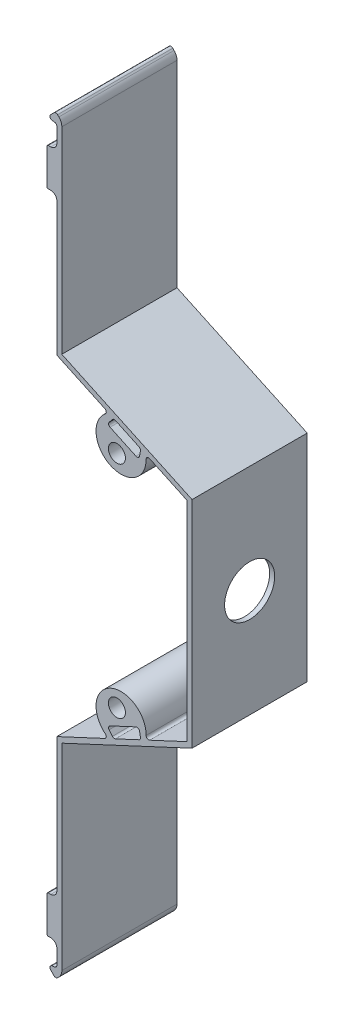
SolidWorks part; units mm, degrees
ref_plane "前视基准面" through (0, 0, 0) normal (0, 0, 1) x (1, 0, 0)
ref_plane "上视基准面" through (0, 0, 0) normal (0, 1, 0) x (1, 0, 0)
ref_plane "右视基准面" through (0, 0, 0) normal (1, 0, 0) x (0, 0, -1)
other "Configuration Table"
sketch "草图1" plane through (0, 0, 0) normal (0, 0, 1) x (1, 0, 0)
  line L2 (95, -72.9584) -> (95, -33.624) construction
  line L3 (95, -33.624) -> (121, -21.5) construction
  line L4 (95, -72.9584) -> (95, -33.624)
  line L5 (95, -33.624) -> (121, -21.5)
  line L7 (121, -21.5) -> (121, 21.5)
  line L8 (95, 33.624) -> (95, 72.9584) construction
  line L9 (95, 33.624) -> (95, 72.9584)
  line L10 (121, -21.5) -> (121, 21.5) construction
  line L11 (120, -20.8629) -> (120, 20.8629)
  line L12 (120, -20.8629) -> (112.5426, -24.3404)
  line L13 (121, 0) -> (102.4527, 0) construction
  line L14 (103.5873, -28.5163) -> (94, -32.9869)
  line L15 (94, -32.9869) -> (94, -72.5446)
  line L16 (93.5609, -73.0408) -> (93.0647, -73.1018)
  line L17 (74.3726, -94.4142) -> (94.4142, -74.3726) construction
  line L18 (94.4142, -74.3726) -> (94.1572, -74.6296)
  line L19 (93.4501, -74.6296) -> (92.772, -73.9516)
  line L20 (93.4501, 74.6296) -> (92.772, 73.9516)
  line L21 (94.4142, 74.3726) -> (94.1572, 74.6296)
  line L22 (93.5609, 73.0408) -> (93.0647, 73.1018)
  line L23 (94, 32.9869) -> (94, 72.5446)
  line L24 (103.5873, 28.5163) -> (94, 32.9869)
  line L25 (120, 20.8629) -> (112.5426, 24.3404)
  line L26 (95, 33.624) -> (121, 21.5)
  line L27 (95, 72.9584) -> (95, 33.624)
  arc A0 (111.8314, -23.8779) -> (103.6902, -27.6742) centre (106.8323, -23.7848) ccw
  arc A1 (94.4142, -74.3726) -> (95, -72.9584) centre (93, -72.9584) ccw construction
  arc A2 (94.4142, -74.3726) -> (95, -72.9584) centre (93, -72.9584) ccw
  arc A3 (94, -72.5446) -> (93.5609, -73.0408) centre (93.5, -72.5446) cw
  arc A4 (94.1572, -74.6296) -> (93.4501, -74.6296) centre (93.8036, -74.2761) cw
  arc A5 (93.0647, -73.1018) -> (92.772, -73.9516) centre (93.1256, -73.598) ccw
  arc A6 (93.0647, 73.1018) -> (92.772, 73.9516) centre (93.1256, 73.598) cw
  arc A7 (94.1572, 74.6296) -> (93.4501, 74.6296) centre (93.8036, 74.2761) ccw
  arc A8 (94, 72.5446) -> (93.5609, 73.0408) centre (93.5, 72.5446) ccw
  arc A9 (94.4142, 74.3726) -> (95, 72.9584) centre (93, 72.9584) cw
  arc A10 (111.8314, 23.8779) -> (103.6902, 27.6742) centre (106.8323, 23.7848) cw
  circle A15 centre (106, 22) radius 1.7
  circle A16 centre (106, -22) radius 1.7
  arc A17 (103.6902, -27.6742) -> (103.5873, -28.5163) centre (103.376, -28.0631) cw
  arc A18 (112.5426, -24.3404) -> (111.8314, -23.8779) centre (112.3313, -23.8872) cw
  arc A19 (111.8314, 23.8779) -> (112.5426, 24.3404) centre (112.3313, 23.8872) cw
  arc A20 (103.6902, 27.6742) -> (103.5873, 28.5163) centre (103.376, 28.0631) ccw
  point P27 (94, -72.9869)
  point P30 (93.8036, -74.9832)
  point P50 (120, 0)
  point P51 (121, 0)
  point P53 (93.8036, 74.9832)
  point P54 (94, 72.9869)
  point P60 (104.3844, -28.1446)
  point P65 (111.7455, -24.7121)
  point P68 (111.7455, 24.7121)
  point P71 (104.3844, 28.1446)
  dimension "D4" = 5
  dimension "D8" = 0.5
  dimension "D9" = 0.5
  dimension "D11" = 3.4
  dimension "D12" = 3.4
  dimension "D13" = 0.5
  dimension "D1" = 1
  dimension "D2" = 1
  dimension "D3" = 1
  dimension "D5" = 11.4579
  dimension "D6" = 9.1078
  dimension "D7" = 40
  dimension "D10" = 97
extrude "凸台-拉伸1" add sketch "草图1" along normal up to surface (23 mm away) contours L13 L7 L26 L9 A9 L21 A7 L20 A6 L22 A8 L23 L24 A20 A10 A19 L25 L11 A15 | L7 L13 L11 L12 A18 A0 A17 L14 L15 A3 L16 A5 L19 A4 L18 A2 L4 L5 A16
sketch "草图2" plane through (0, 0, 23) normal (0, 0, 1) x (1, 0, 0)
  line L0 (95, 33.624) -> (121, 21.5) construction
  line L1 (105.346, 27.6962) -> (110.7839, 25.1605)
  line L2 (105.346, 27.6962) -> (104.0476, 26.0949)
  line L3 (104.0476, 26.0949) -> (110.3918, 23.1365)
  line L4 (110.7839, 25.1605) -> (110.3918, 23.1365)
  line L5 (106, 22) -> (108.4876, 27.3346) construction
  point P6 (108.065, 26.4283)
  point P10 (107.2197, 24.6157)
  dimension "D1" = 1
  dimension "D2" = 2
  dimension "D3" = 7
  dimension "D4" = 6
extrude "切除-拉伸1" cut sketch "草图2" against normal up to surface (23 mm away)
fillet "圆角1" radius 0.5 4 edges at (104.0476, 26.0949, 11.5) (105.346, 27.6962, 11.5) (110.7839, 25.1605, 11.5) (110.3918, 23.1365, 11.5)
mirror "镜向1" about plane through (0, 0, 0) normal (0, 1, 0) of "圆角1", "切除-拉伸1"
sketch "草图3" plane through (95, 0, 0) normal (1, 0, 0) x (0, 0, -1)
  line L0 (-11.5, 22.1215) -> (-11.5, -20.8785) construction
  line L1 (-23, -21.5) -> (0, -21.5) construction
  line L2 (-11.5, -21.5) -> (-11.5, -11.2317) construction
  line L3 (-23, -74.6296) -> (0, -74.6296) construction
  circle A0 centre (-4.5, -64.6296) radius 2.85
  circle A1 centre (-11.5, -64.6296) radius 2.85
  circle A2 centre (-18.5, -64.6296) radius 2.85
  dimension "D1" = 5.7
  dimension "D2" = 14
  dimension "D3" = 10
extrude "切除-拉伸2" cut sketch "草图3" against normal blind 10
sketch "草图4" plane through (94, 0, 0) normal (-1, 0, 0) x (0, 0, 1)
  line L0 (11.5, -64.6296) -> (23, -64.6296) construction
  line L1 (23, -32.9869) -> (23, -72.5446) construction
  line L2 (0, -32.9869) -> (0, -72.5446) construction
  line L3 (23, -68.3796) -> (0, -68.3796)
  line L4 (23, -68.3796) -> (23, -60.8796)
  line L5 (23, -60.8796) -> (0, -60.8796)
  line L6 (0, -68.3796) -> (0, -60.8796)
  circle A0 centre (18.5, -64.6296) radius 2.85 construction
  circle A1 centre (11.5, -64.6296) radius 2.85 construction
  circle A2 centre (4.5, -64.6296) radius 2.85 construction
  circle A3 centre (18.5, -64.6296) radius 2.85
  circle A4 centre (11.5, -64.6296) radius 2.85
  circle A5 centre (4.5, -64.6296) radius 2.85
  dimension "D1" = 7.5
extrude "凸台-拉伸2" add sketch "草图4" along normal blind 2
fillet "圆角2" radius 1.2 2 edges at (94, -60.8796, 11.5) (94, -68.3796, 11.5)
fillet "圆角3" radius 0.3 2 edges at (92, -68.3796, 11.5) (92, -60.8796, 11.5)
mirror "镜向3" about plane through (0, 0, 0) normal (0, 1, 0) of "切除-拉伸2", "凸台-拉伸2"
fillet "圆角4" radius 1.2 2 edges at (94, 60.8796, 11.5) (94, 68.3796, 11.5)
fillet "圆角5" radius 0.3 2 edges at (92, 68.3796, 11.5) (92, 60.8796, 11.5)
sketch "草图6" plane through (95, 0, 0) normal (1, 0, 0) x (0, 0, -1)
  circle A0 centre (-4.5, -64.6296) radius 2.85 construction
  circle A1 centre (-11.5, -64.6296) radius 2.85 construction
  circle A2 centre (-18.5, -64.6296) radius 2.85 construction
  circle A3 centre (-4.5, 64.6296) radius 2.85 construction
  circle A4 centre (-11.5, 64.6296) radius 2.85 construction
  circle A5 centre (-18.5, 64.6296) radius 2.85 construction
  circle A6 centre (-4.5, -64.6296) radius 2.85
  circle A7 centre (-11.5, -64.6296) radius 2.85
  circle A8 centre (-18.5, -64.6296) radius 2.85
  circle A9 centre (-4.5, 64.6296) radius 2.85
  circle A10 centre (-11.5, 64.6296) radius 2.85
  circle A11 centre (-18.5, 64.6296) radius 2.85
extrude "凸台-拉伸3" add sketch "草图6" against normal up to surface (3 mm away)
sketch "草图5" plane through (121, 0, 0) normal (1, 0, 0) x (0, 0, -1)
  line L0 (0, 0) -> (-23, 0) construction
  line L1 (-23, -21.5) -> (-23, 21.5) construction
  circle A0 centre (-11.5, 0) radius 5
  dimension "D1" = 10
extrude "切除-拉伸3" cut sketch "草图5" against normal blind 10
